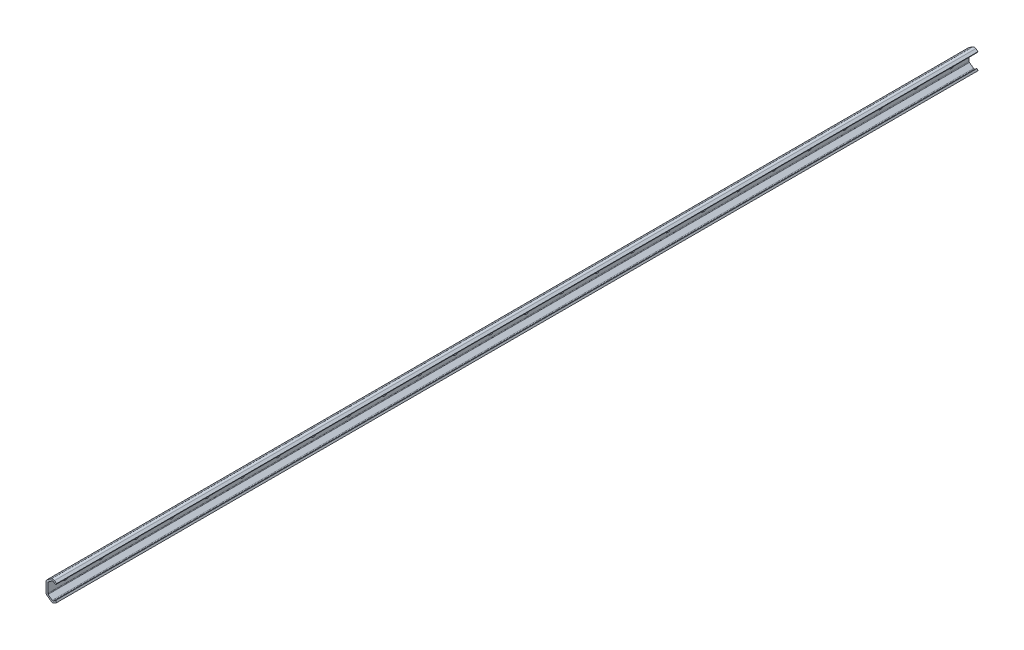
SolidWorks part; units mm, degrees
ref_plane "Front Plane" through (0, 0, 0) normal (0, 0, 1) x (1, 0, 0)
ref_plane "Top Plane" through (0, 0, 0) normal (0, 1, 0) x (1, 0, 0)
ref_plane "Right Plane" through (0, 0, 0) normal (1, 0, 0) x (0, 0, -1)
sketch "Sketch1" plane through (0, 0, 0) normal (0, 0, 1) x (1, 0, 0)
  line L0 (21.7057, -15.4016) -> (24, -18.6782)
  line L1 (24, -18.6782) -> (19.0362, -22.1539)
  line L2 (11.9638, -22.1539) -> (3.3719, -16.1378)
  line L3 (0, -10.44) -> (0, 10.44)
  line L4 (3.3719, 16.1378) -> (11.9638, 22.1539)
  line L5 (19.0362, 22.1539) -> (24, 18.6782)
  line L6 (24, 18.6782) -> (21.7057, 15.4016)
  line L7 (21.7057, 15.4016) -> (16.814, 18.8268)
  line L8 (14.186, 18.8268) -> (4.7304, 12.206)
  line L9 (4.7304, -12.206) -> (14.186, -18.8268)
  line L10 (4, 10.44) -> (4, -10.44)
  line L11 (16.814, -18.8268) -> (21.7057, -15.4016)
  arc A0 (19.0362, -22.1539) -> (11.9638, -22.1539) centre (15.5, -17.1036) cw
  arc A1 (0, -10.44) -> (3.3719, -16.1378) centre (6.5, -10.44) ccw
  arc A2 (0, 10.44) -> (3.3719, 16.1378) centre (6.5, 10.44) cw
  arc A3 (11.9638, 22.1539) -> (19.0362, 22.1539) centre (15.5, 17.1036) cw
  arc A4 (16.814, 18.8268) -> (14.186, 18.8268) centre (15.5, 16.9503) ccw
  arc A5 (4.7304, 12.206) -> (4, 10.44) centre (5.7497, 10.7503) ccw
  arc A6 (4, -10.44) -> (4.7304, -12.206) centre (6.5, -10.44) ccw
  arc A7 (14.186, -18.8268) -> (16.814, -18.8268) centre (15.5, -16.9503) ccw
  dimension "D1" = 6.1652
  dimension "D2" = 6.5
  dimension "D3" = 6.5
  dimension "D4" = 6.1652
  dimension "D5" = 2.2909
  dimension "D6" = 1.777
  dimension "D7" = 2.5
  dimension "D8" = 2.2909
  dimension "D9" = 3.3719
  dimension "D10" = 3.3719
  dimension "D11" = 4
  dimension "D12" = 4.7304
  dimension "D13" = 4.7304
  dimension "D14" = 5.7497
  dimension "D15" = 6.5
  dimension "D16" = 11.9638
  dimension "D17" = 14.186
  dimension "D18" = 15.5
  dimension "D19" = 11.9638
  dimension "D20" = 15.5
  dimension "D21" = 14.186
  dimension "D22" = 16.814
  dimension "D23" = 10.44
  dimension "D24" = 10.44
  dimension "D25" = 16.814
  dimension "D29" = 21.7057
  dimension "D30" = 21.7057
  dimension "D31" = 24
  dimension "D32" = 24
extrude "Extrude1" add sketch "Sketch1" against normal blind 2080
sketch "Sketch2" plane through (4, 0, 0) normal (1, 0, 0) x (0, 0, -1)
  line L0 (39, 0) -> (41, 0) construction
  line L1 (39, 4.5) -> (41, 4.5)
  line L2 (39, -4.5) -> (41, -4.5)
  arc A0 (39, 4.5) -> (39, -4.5) centre (39, 0) ccw
  arc A1 (41, 4.5) -> (41, -4.5) centre (41, 0) cw
  point P7 (40, 0)
  dimension "D1" = 2
  dimension "D2" = 9
  dimension "D3" = 40
extrude "Extrude2" cut sketch "Sketch2" against normal through all
pattern_linear "LPattern1" count 26 spacing 80 along (0, 0, -1) of "Extrude2"
